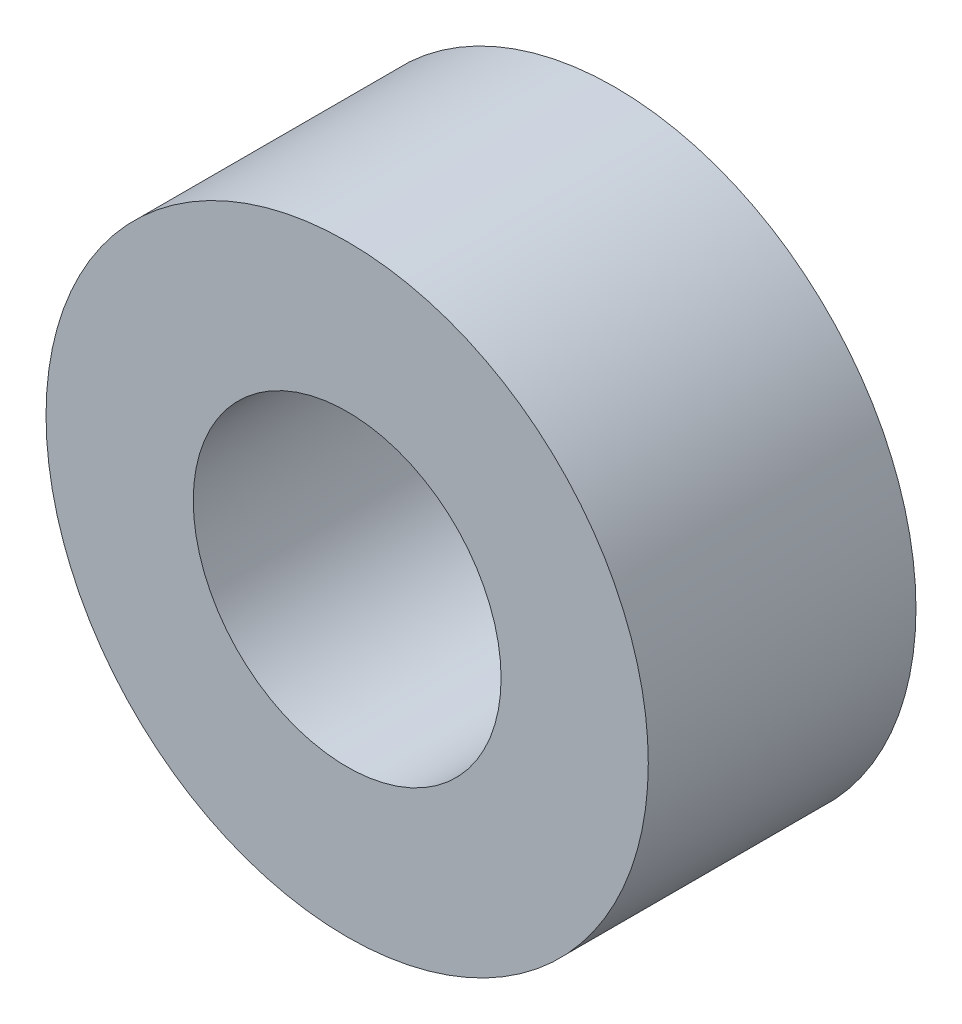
SolidWorks part; units mm, degrees
ref_plane "Plan de face" through (0, 0, 0) normal (0, 0, 1) x (1, 0, 0)
ref_plane "Plan de dessus" through (0, 0, 0) normal (0, 1, 0) x (1, 0, 0)
ref_plane "Plan de droite" through (0, 0, 0) normal (1, 0, 0) x (0, 0, -1)
sketch "Esquisse1" plane through (0, 0, 0) normal (0, 0, 1) x (1, 0, 0)
  circle A0 centre (0, 0) radius 4.6
  circle A1 centre (0, 0) radius 9
  dimension "D1" = 18
  dimension "D2" = 9.2
extrude "Boss.-Extru.1" add sketch "Esquisse1" along normal blind 8
